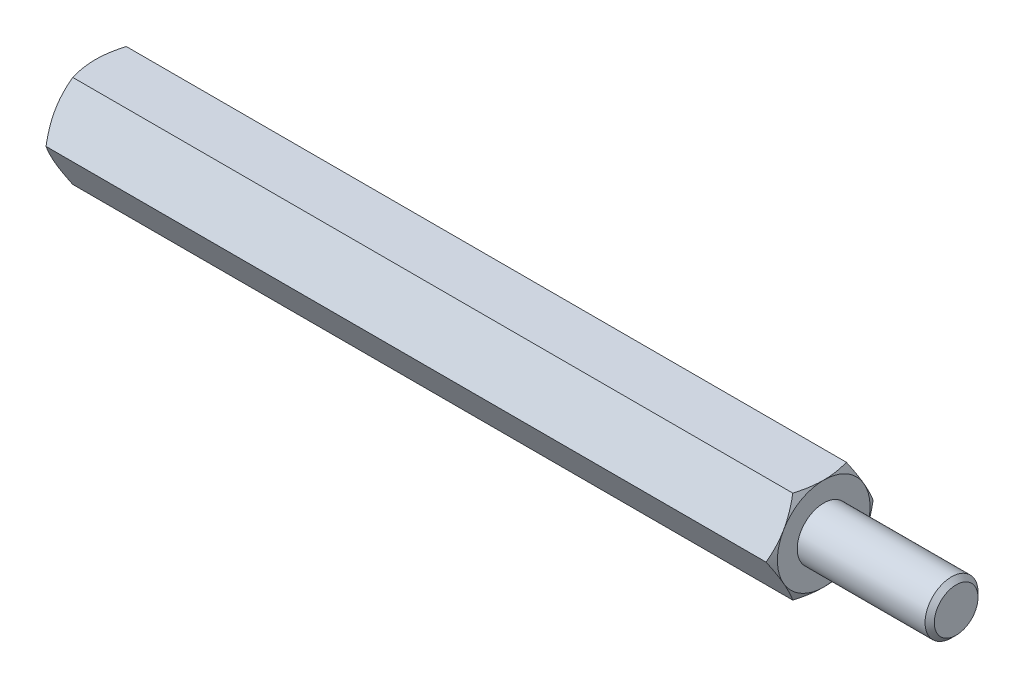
SolidWorks part; units mm, degrees
ref_plane "Front Plane" through (0, 0, 0) normal (0, 0, 1) x (1, 0, 0)
ref_plane "Top Plane" through (0, 0, 0) normal (0, 1, 0) x (1, 0, 0)
ref_plane "Right Plane" through (0, 0, 0) normal (1, 0, 0) x (0, 0, -1)
sketch "Sketch1" plane through (0, 0, 0) normal (1, 0, 0) x (0, 0, -1)
  line L1 (2.0207, 3.5) -> (-2.0207, 3.5)
  line L2 (-2.0207, 3.5) -> (-4.0415, 0)
  line L3 (-4.0415, 0) -> (-2.0207, -3.5)
  line L4 (-2.0207, -3.5) -> (2.0207, -3.5)
  line L5 (2.0207, -3.5) -> (4.0415, 0)
  line L6 (4.0415, 0) -> (2.0207, 3.5)
  circle A0 centre (0, 0) radius 3.5 construction
  dimension "D1" = 7
extrude "Extrude2" add sketch "Sketch1" along normal mid plane 55
sketch "Sketch2" plane through (0, 0, 0) normal (0, 0, 1) x (1, 0, 0)
  line L0 (-27.5, 3.5) -> (-26, 6.0981)
  line L1 (-27.5, 6.5) -> (-27.5, 3.5)
  line L3 (0, 0) -> (50000, 0) construction
  arc A0 (-26, 6.0981) -> (-27.5, 6.5) centre (-26.6962, 6.5) ccw
  dimension "D1" = 30
  dimension "D2" = 3
revolve "Cut-Revolve1" cut sketch "Sketch2" angle 360 about L3
mirror "Mirror1" about plane through (0, 0, 0) normal (1, 0, 0) of "Cut-Revolve1"
sketch "Sketch3" plane through (-27.5, 0, 0) normal (-1, 0, 0) x (0, 0, 1)
  circle A0 centre (0, 0) radius 1.65
  dimension "D1" = 3.3
extrude "Extrude3" cut sketch "Sketch3" against normal blind 10
sketch "Sketch4" plane through (0, 0, 0) normal (0, 0, 1) x (1, 0, 0)
  line L0 (-17.5, 0) -> (-17.5, 1.65)
  line L1 (27.1874, 0) -> (-27.1874, 0) construction
  line L2 (-17.5, 1.65) -> (-16.5474, 0)
  line L3 (-16.5474, 0) -> (-17.5, 0)
  line L4 (-27.5, 1.75) -> (-27.5, -1.75) construction
  point P4 (-27.5, 0)
  dimension "D1" = 30
  dimension "D2" = 1.65
  dimension "D3" = 10
revolve "Cut-Revolve2" cut sketch "Sketch4" angle 360 about L3
sketch "Sketch5" plane through (27.5, 0, 0) normal (1, 0, 0) x (0, 0, -1)
  circle A0 centre (0, 0) radius 2
  dimension "D1" = 4
extrude "Extrude4" add sketch "Sketch5" along normal blind 10
chamfer "Chamfer1" distance 0.35 angle 45 1 edges at (37.5, 0, -2)
equation "\"D2@Sketch4\" = \"D1@Sketch3\"/2"
